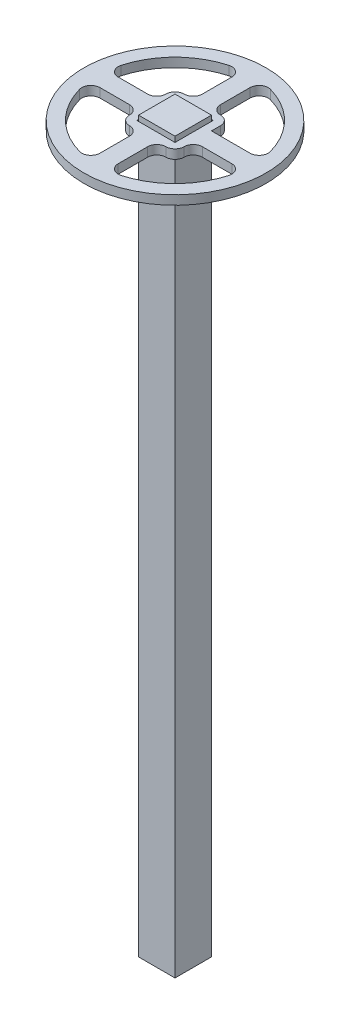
SolidWorks part; units mm, degrees
ref_plane "Plan de face" through (0, 0, 0) normal (0, 0, 1) x (1, 0, 0)
ref_plane "Plan de dessus" through (0, 0, 0) normal (0, 1, 0) x (1, 0, 0)
ref_plane "Plan de droite" through (0, 0, 0) normal (1, 0, 0) x (0, 0, -1)
sketch "Esquisse1" plane through (0, 0, 0) normal (0, 0, 1) x (1, 0, 0)
  line L0 (0, 0) -> (0, 800)
  dimension "D1" = 800
other "Barres carrées C40(1)"
ref_plane "Plan4" through (0, 0, 0) normal (0, 1, 0) x (-1, 0, 0)
sketch "Esquisse11" plane through (0, 0, 0) normal (0, 1, 0) x (-1, 0, 0)
  line L0 (0, -20) -> (0, 20) construction
  line L1 (-20, 20) -> (20, 20)
  line L2 (-20, 20) -> (-20, -20)
  line L3 (-20, -20) -> (20, -20)
  line L4 (20, 20) -> (20, -20)
  line L5 (-20, 0) -> (20, 0) construction
  point P8 (0, 0)
  dimension "D1" = 40
sketch "Esquisse12" plane through (0, 0, 0) normal (0, -1, 0) x (1, 0, 0)
  line L1 (7.5, 7.5) -> (-7.5, 7.5)
  line L2 (7.5, 7.5) -> (7.5, -7.5)
  line L3 (7.5, -7.5) -> (-7.5, -7.5)
  line L4 (-7.5, 7.5) -> (-7.5, -7.5)
  line L5 (7.5, 7.5) -> (-7.5, -7.5) construction
  line L6 (7.5, -7.5) -> (-7.5, 7.5) construction
  point P0 (0, 0)
  dimension "D1" = 15
extrude "Enlèv. mat.-Extru.1" cut sketch "Esquisse12" against normal blind 16.5
ref_plane "Plan5" through (0, 785, 0) normal (0, 1, 0) x (1, 0, 0)
sketch "Esquisse13" plane through (0, 785, 0) normal (0, 1, 0) x (1, 0, 0)
  line L4 (21, 21) -> (-21, 21)
  line L6 (-21, 21) -> (-21, -21)
  line L7 (-21, -21) -> (21, -21)
  line L8 (21, -21) -> (21, 21)
  circle A96 centre (0, 0) radius 100
  dimension "D1" = 200
base flange "Tôle de base pliée1" sketch "Esquisse13" thickness 10 reverse thickness direction yes parameters "D1"=10
sketch "Esquisse14" plane through (0, 795, 0) normal (0, 1, 0) x (1, 0, 0)
  line L0 (10, -30) -> (30, -30)
  line L1 (10, 30) -> (10, 84.4097)
  line L2 (-10, 30) -> (-10, 84.4097)
  line L3 (30, 10) -> (30, 30)
  line L4 (-10, 30) -> (-30, 30)
  line L10 (-30, 10) -> (-84.4097, 10)
  line L11 (-30, -10) -> (-84.4097, -10)
  line L14 (10, -30) -> (10, -84.4097)
  line L15 (-10, -30) -> (-10, -84.4097)
  line L16 (30, -10) -> (84.4097, -10)
  line L17 (30, 10) -> (84.4097, 10)
  line L27 (30, 30) -> (10, 30)
  line L28 (-30, 30) -> (-30, 10)
  line L29 (-30, -30) -> (-10, -30)
  line L30 (30, -30) -> (30, -10)
  line L31 (-30, -10) -> (-30, -30)
  arc A0 (-10, 84.4097) -> (-84.4097, 10) centre (0, 0) ccw
  arc A1 (-84.4097, -10) -> (-10, -84.4097) centre (0, 0) ccw
  arc A2 (10, -84.4097) -> (84.4097, -10) centre (0, 0) ccw
  arc A3 (84.4097, 10) -> (10, 84.4097) centre (0, 0) ccw
  dimension "D1" = 170
extrude "Enlèv. mat.-Extru.2" cut sketch "Esquisse14" against normal blind 10
fillet "Congé1" radius 10 19 edges at (-84.4097, 790, -10) (-84.4097, 790, 10) (-10, 790, 84.4097) (10, 790, 84.4097) (84.4097, 790, 10) (84.4097, 790, -10) (-10, 790, -84.4097) (10, 790, -84.4097) (10, 790, -30) (-10, 790, -30) (-30, 790, -30) (-30, 790, -10) (-30, 790, 10) (-30, 790, 30) (-10, 790, 30) (10, 790, 30) (30, 790, 10) (30, 790, 30) (30, 790, -30)
sketch "Lignes de pliage1" [suppressed] plane through (0, 0, 0) normal (0, 1, 0) x (1, 0, 0)
sketch "Cube de visualisation1" [suppressed] plane through (0, 0, 0) normal (0, 1, 0) x (1, 0, 0)
sheet metal parameters "Tôlerie3" thickness 10 parameters "D1"=10
flat pattern "Etat déplié3"
sketch "Lignes de pliage2" plane through (0, 0, 0) normal (0, 1, 0) x (1, 0, 0)
sketch3d "Cube de visualisation2" [suppressed]
  line L0 (-100.1249, -99.8748, 0) -> (99.8749, -100.1248, 0) construction
  line L1 (-99.8749, 100.1249, 0) -> (100.1249, 99.8749, 0) construction
  line L2 (-100.1249, -99.8748, 0) -> (-99.8749, 100.1249, 0) construction
  line L3 (99.8749, -100.1248, 0) -> (100.1249, 99.8749, 0) construction
sheet metal parameters "Tôlerie4" thickness 10 parameters "D1"=10
flat pattern "Etat déplié3"
sketch "Lignes de pliage2" plane through (0, 0, 0) normal (0, 1, 0) x (1, 0, 0)
sketch3d "Cube de visualisation2" [suppressed]
  line L0 (-100.1249, -99.8748, 0) -> (99.8749, -100.1248, 0) construction
  line L1 (-99.8749, 100.1249, 0) -> (100.1249, 99.8749, 0) construction
  line L2 (-100.1249, -99.8748, 0) -> (-99.8749, 100.1249, 0) construction
  line L3 (99.8749, -100.1248, 0) -> (100.1249, 99.8749, 0) construction
